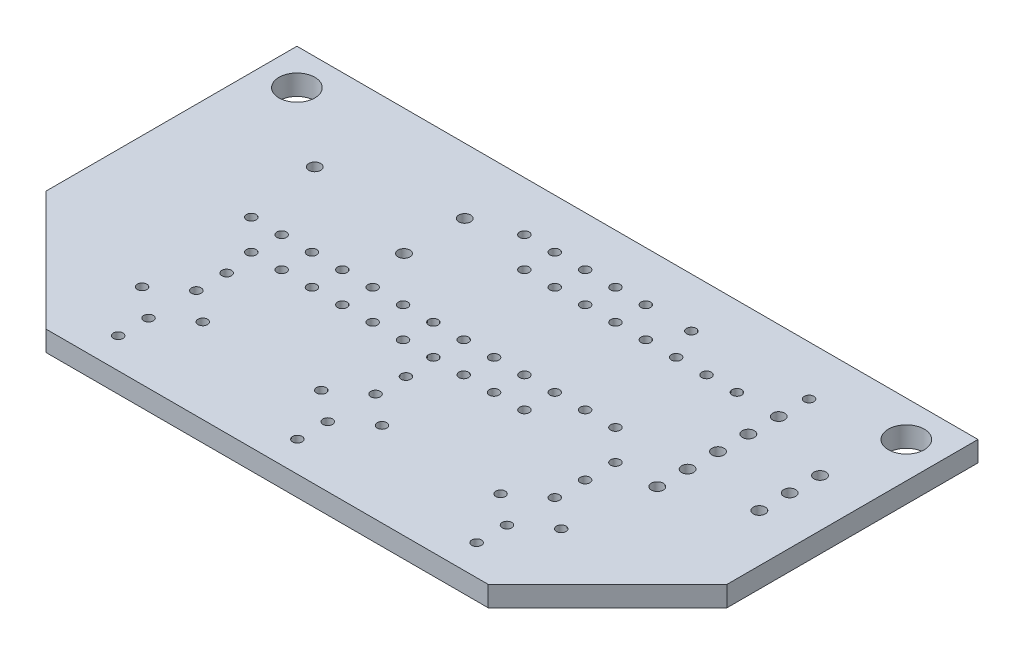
SolidWorks part; units mm, degrees
ref_plane "Plan de face" through (0, 0, 0) normal (0, 0, 1) x (1, 0, 0)
ref_plane "Plan de dessus" through (0, 0, 0) normal (0, 1, 0) x (1, 0, 0)
ref_plane "Plan de droite" through (0, 0, 0) normal (1, 0, 0) x (0, 0, -1)
sketch "Esquisse1" plane through (0, 0, 0) normal (0, 1, 0) x (1, 0, 0)
  line L0 (-55.0409, 0) -> (53.7356, 0) construction
  line L1 (0, -15.3375) -> (0, 42.5316) construction
  line L2 (-55.0409, 31) -> (53.7356, 31) construction
  line L3 (28.5, 49.7108) -> (28.5, -15.3375) construction
  line L4 (-28.5, -15.3375) -> (-28.5, 49.7108) construction
  line L5 (18.5, -8.4216) -> (18.5, 5.5761) construction
  line L6 (18.5, 0) -> (31.1747, 12.6747) construction
  line L7 (18.5, 0) -> (28.5, 10)
  line L8 (-18.5, 0) -> (-28.5, 10)
  line L9 (18.5, 0) -> (-18.5, 0)
  line L10 (-28.5, 10) -> (-28.5, 31)
  line L11 (-28.5, 31) -> (28.5, 31)
  line L12 (28.5, 31) -> (28.5, 10)
  line L13 (-4.1524, 2.54) -> (19.9169, 2.54) construction
  line L14 (-4.1524, 5.08) -> (14.1317, 5.08) construction
  line L15 (-4.1524, 9.08) -> (14.1317, 9.08) construction
  line L16 (-4.1524, 11.62) -> (14.1317, 11.62) construction
  line L17 (-4.7551, 7.08) -> (5.3471, 7.08) construction
  line L18 (-2.54, 9.6779) -> (-2.54, 6.3293) construction
  line L19 (2.54, 9.6779) -> (2.54, 6.3293) construction
  line L20 (31.1747, 28) -> (24.2659, 28) construction
  line L21 (25.5, 32.8728) -> (25.5, 26.441) construction
  line L22 (15, -3.0208) -> (15, 32.8728) construction
  line L23 (29.937, 14.16) -> (-30.6463, 14.16) construction
  line L24 (-35.9716, 23) -> (-4.1524, 23) construction
  line L25 (-9, 35.57) -> (-9, 18.2802) construction
  line L26 (-11.1435, 20.46) -> (-6.579, 20.46) construction
  line L27 (-11.1435, 25.54) -> (-6.579, 25.54) construction
  line L28 (-19.01, 27.5475) -> (-19.01, 20.2858) construction
  circle A0 centre (0, 2.54) radius 0.4
  circle A1 centre (0, 5.08) radius 0.4
  circle A2 centre (0, 9.08) radius 0.4
  circle A3 centre (0, 11.62) radius 0.4
  circle A4 centre (-2.54, 7.08) radius 0.4
  circle A5 centre (2.54, 7.08) radius 0.4
  circle A6 centre (15, 2.54) radius 0.4
  circle A7 centre (15, 5.08) radius 0.4
  circle A8 centre (17.54, 7.08) radius 0.4
  circle A9 centre (15, 9.08) radius 0.4
  circle A10 centre (12.46, 7.08) radius 0.4
  circle A11 centre (15, 11.62) radius 0.4
  circle A12 centre (-15, 11.62) radius 0.4
  circle A13 centre (-12.46, 7.08) radius 0.4
  circle A14 centre (-15, 9.08) radius 0.4
  circle A15 centre (-17.54, 7.08) radius 0.4
  circle A16 centre (-15, 5.08) radius 0.4
  circle A17 centre (-15, 2.54) radius 0.4
  circle A18 centre (25.5, 28) radius 1.5
  circle A19 centre (-25.5, 28) radius 1.5
  circle A20 centre (15, 14.16) radius 0.4
  circle A21 centre (18.5, 14.16) radius 0.5
  circle A22 centre (-5.32, 14.16) radius 0.4
  circle A23 centre (18.5, 16.7) radius 0.5
  circle A24 centre (-5.32, 16.7) radius 0.4
  circle A25 centre (18.5, 19.24) radius 0.5
  circle A26 centre (-7.86, 14.16) radius 0.4
  circle A27 centre (18.5, 21.78) radius 0.5
  circle A28 centre (15, 24.32) radius 0.4
  circle A29 centre (18.5, 24.32) radius 0.5
  circle A30 centre (24.5, 16.7) radius 0.5
  circle A31 centre (24.5, 19.24) radius 0.5
  circle A32 centre (24.5, 21.78) radius 0.5
  circle A33 centre (-7.86, 16.7) radius 0.4
  circle A34 centre (12.46, 16.7) radius 0.4
  circle A35 centre (-10.4, 14.16) radius 0.4
  circle A36 centre (-10.4, 16.7) radius 0.4
  circle A37 centre (12.46, 24.32) radius 0.4
  circle A38 centre (-12.94, 14.16) radius 0.4
  circle A39 centre (9.92, 16.7) radius 0.4
  circle A40 centre (-12.94, 16.7) radius 0.4
  circle A41 centre (-15.48, 14.16) radius 0.4
  circle A42 centre (9.92, 24.32) radius 0.4
  circle A43 centre (7.38, 14.16) radius 0.4
  circle A44 centre (7.38, 16.7) radius 0.4
  circle A45 centre (-15.48, 16.7) radius 0.4
  circle A46 centre (-9, 20.46) radius 0.5
  circle A47 centre (7.38, 24.32) radius 0.4
  circle A48 centre (4.84, 14.16) radius 0.4
  circle A49 centre (4.84, 16.7) radius 0.4
  circle A50 centre (-18.02, 16.7) radius 0.4
  circle A51 centre (-9, 25.54) radius 0.5
  circle A52 centre (4.84, 24.32) radius 0.4
  circle A53 centre (2.3, 14.16) radius 0.4
  circle A54 centre (2.3, 16.7) radius 0.4
  circle A55 centre (-19.01, 23) radius 0.5
  circle A56 centre (18.5, 26.86) radius 0.4
  circle A57 centre (2.3, 24.32) radius 0.4
  circle A58 centre (-0.24, 14.16) radius 0.4
  circle A59 centre (-0.24, 16.7) radius 0.4
  circle A60 centre (4.84, 26.86) radius 0.4
  circle A61 centre (2.3, 26.86) radius 0.4
  circle A62 centre (-0.24, 24.32) radius 0.4
  circle A63 centre (-2.78, 14.16) radius 0.4
  circle A64 centre (-2.78, 16.7) radius 0.4
  circle A65 centre (-0.24, 26.86) radius 0.4
  circle A66 centre (-2.78, 26.86) radius 0.4
  circle A67 centre (-2.78, 24.32) radius 0.4
  circle A68 centre (15, 16.7) radius 0.4
  circle A70 centre (15, 19.24) radius 0.4
  circle A72 centre (15, 21.78) radius 0.4
  circle A88 centre (12.46, 14.16) radius 0.4
  circle A89 centre (9.92, 14.16) radius 0.4
  circle A90 centre (-18.02, 14.16) radius 0.4
  circle A91 centre (-5.32, 26.86) radius 0.4
  circle A93 centre (8.65, 26.86) radius 0.4
  dimension "D7" = 2.54
  dimension "D11" = 2.54
  dimension "D13" = 3
  dimension "D15" = 2.54
  dimension "D16" = 19.5
  dimension "D21" = 2
  dimension "D1" = 28.5
  dimension "D2" = 57
  dimension "D3" = 31
  dimension "D4" = 10
  dimension "D5" = 45
  dimension "D6" = 2.54
  dimension "D8" = 2
  dimension "D9" = 2
  dimension "D10" = 2.54
  dimension "D12" = 5.08
  dimension "D14" = 3
  dimension "D17" = 8
  dimension "D18" = 2.54
  dimension "D19" = 5.08
  dimension "D20" = 10.01
  dimension "D22" = 2
extrude "Extrusion1" add sketch "Esquisse1" along normal blind 1.7
